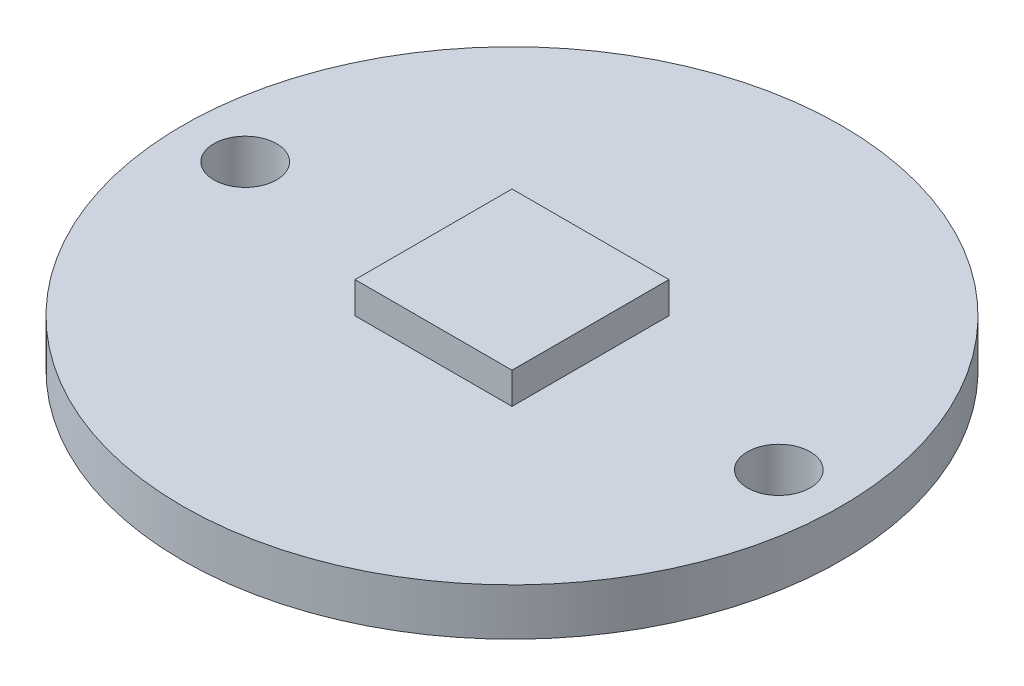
SolidWorks part; units mm, degrees
ref_plane "Front Plane" through (0, 0, 0) normal (0, 0, 1) x (1, 0, 0)
ref_plane "Top Plane" through (0, 0, 0) normal (0, 1, 0) x (1, 0, 0)
ref_plane "Right Plane" through (0, 0, 0) normal (1, 0, 0) x (0, 0, -1)
sketch "Sketch1" plane through (0, 0, 0) normal (0, 1, 0) x (1, 0, 0)
  line L0 (-8.5, 0) -> (8.5, 0) construction
  circle A0 centre (0, 0) radius 10.5
  circle A1 centre (-8.5, 0) radius 1
  circle A2 centre (8.5, 0) radius 1
  point P10 (0, 0)
  dimension "D1" = 21
  dimension "D2" = 2
  dimension "D3" = 2
  dimension "D4" = 17
extrude "Boss-Extrude1" add sketch "Sketch1" along normal blind 1.5
sketch "Sketch2" plane through (0, 1.5, 0) normal (0, 1, 0) x (1, 0, 0)
  line L1 (-2.5, -2.5) -> (2.5, -2.5)
  line L2 (-2.5, -2.5) -> (-2.5, 2.5)
  line L3 (-2.5, 2.5) -> (2.5, 2.5)
  line L4 (2.5, -2.5) -> (2.5, 2.5)
  line L5 (-2.5, -2.5) -> (2.5, 2.5) construction
  line L6 (-2.5, 2.5) -> (2.5, -2.5) construction
  point P0 (0, 0)
  dimension "D1" = 5
  dimension "D2" = 5
extrude "Boss-Extrude2" add sketch "Sketch2" along normal blind 1
